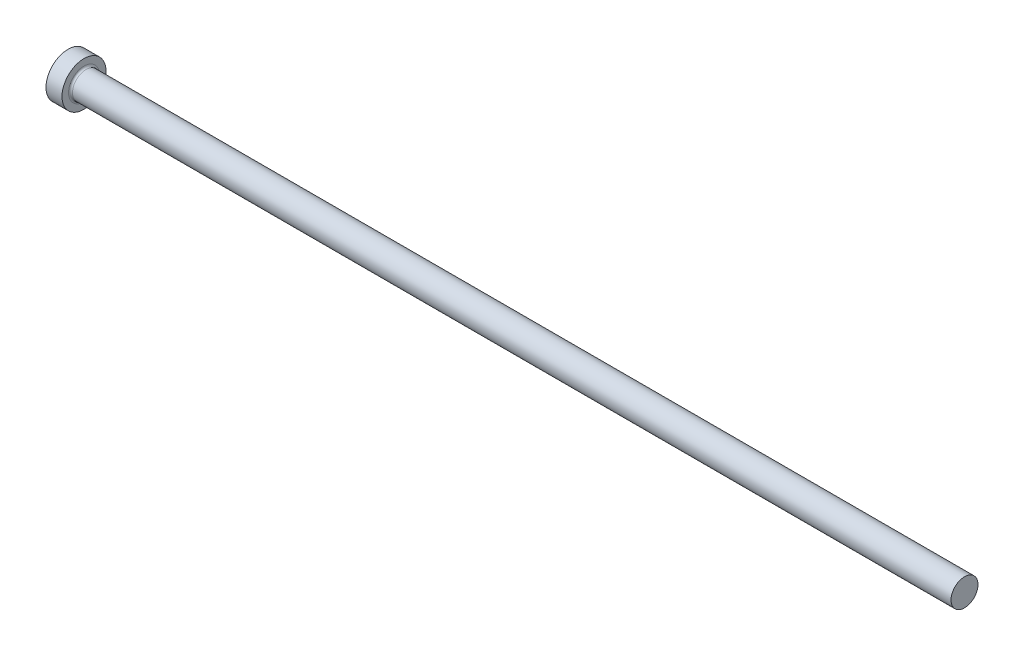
SolidWorks part; units mm, degrees
ref_plane "Front Plane" through (0, 0, 0) normal (0, 0, 1) x (1, 0, 0)
ref_plane "Top Plane" through (0, 0, 0) normal (0, 1, 0) x (1, 0, 0)
ref_plane "Right Plane" through (0, 0, 0) normal (1, 0, 0) x (0, 0, -1)
sketch "Sketch1" plane through (0, 0, 0) normal (0, 0, 1) x (1, 0, 0)
  line L0 (0, 0) -> (0, 8.7312)
  line L1 (0, 8.7312) -> (6.35, 8.7312)
  line L2 (6.35, 8.7312) -> (6.35, 6.1392)
  line L3 (7.1374, 5.3518) -> (355.6, 5.3518)
  line L4 (355.6, 5.3518) -> (355.6, 0)
  line L5 (355.6, 0) -> (0, 0)
  line L6 (355.6, 0) -> (0, 0) construction
  line L7 (0, 0) -> (-10.4771, 0) construction
  line L8 (355.6, 0) -> (1002.3976, 0) construction
  arc A0 (7.1374, 5.3518) -> (6.35, 6.1392) centre (7.1374, 6.1392) cw
  dimension "D1" = 0.7874
  dimension "HeadDia" = 17.4625
  dimension "HeadThickness" = 6.35
  dimension "PinDia" = 10.7036
  dimension "overall" = 355.6
revolve "PIN" add sketch "Sketch1" angle 360 about L6
